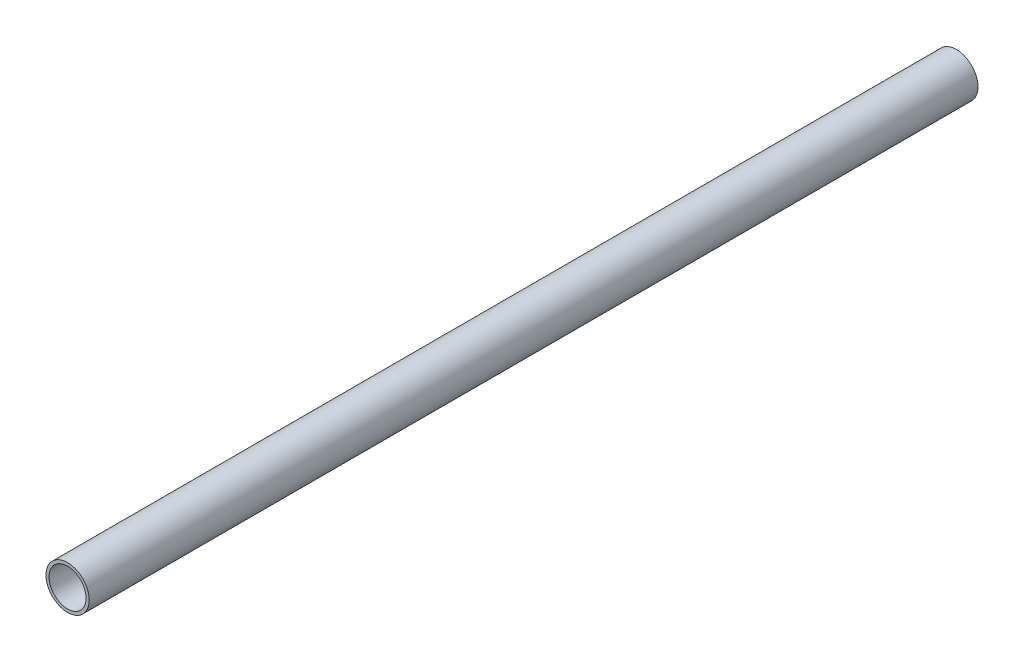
SolidWorks part; units mm, degrees
ref_plane "Front" through (0, 0, 0) normal (0, 0, 1) x (1, 0, 0)
ref_plane "Top" through (0, 0, 0) normal (0, 1, 0) x (1, 0, 0)
ref_plane "Right" through (0, 0, 0) normal (1, 0, 0) x (0, 0, -1)
sketch "Sketch1" plane through (0, 0, 0) normal (0, 0, 1) x (1, 0, 0)
  circle A0 centre (0, 0) radius 9.525
  dimension "D1" = 19.05
extrude "Extrude-Thin1" add sketch "Sketch1" against normal blind 457.2 thin
